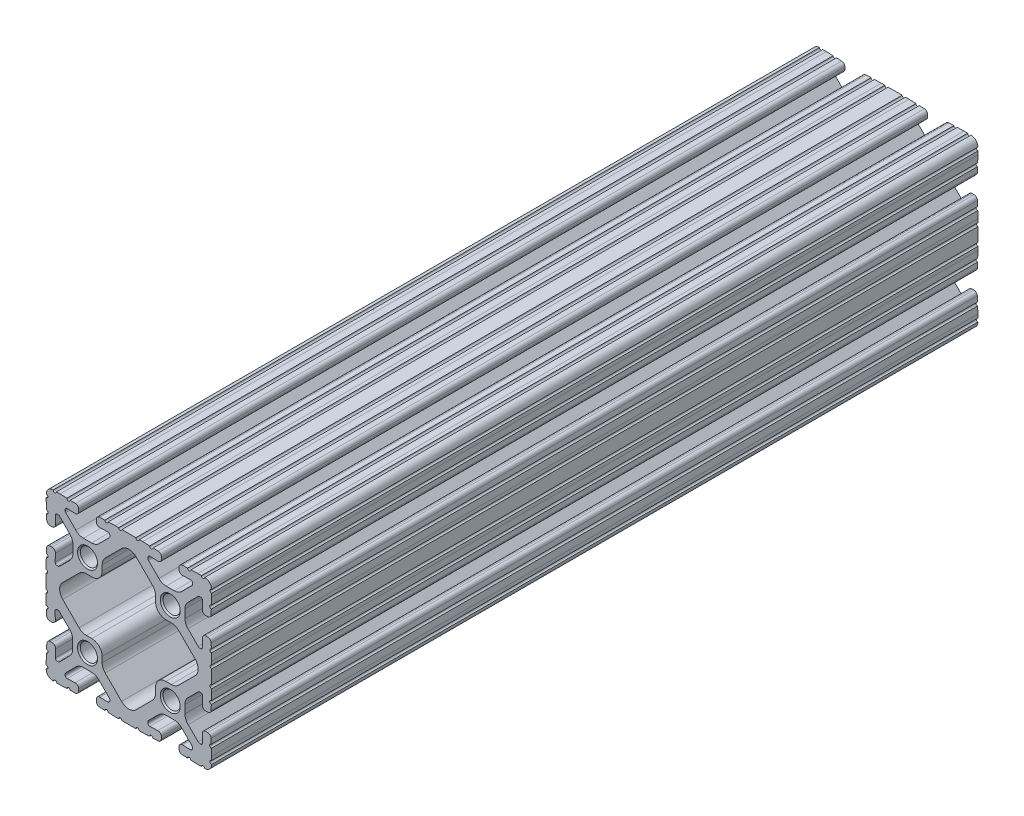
SolidWorks part; units mm, degrees
ref_plane "Front" through (0, 0, 0) normal (0, 0, 1) x (1, 0, 0)
ref_plane "Top" through (0, 0, 0) normal (0, 1, 0) x (1, 0, 0)
ref_plane "Right" through (0, 0, 0) normal (1, 0, 0) x (0, 0, -1)
sketch "Sketch2" plane through (0, 0, 0) normal (0, 0, 1) x (1, 0, 0)
  line L142 (52.4544, 57.1407) -> (50.8101, 57.141)
  line L143 (50.8101, 57.141) -> (47.6093, 57.0298)
  line L144 (46.0862, 56.9768) -> (43.6939, 56.8937)
  line L145 (42.1738, 55.3201) -> (42.1737, 54.4052)
  line L146 (43.8031, 52.8311) -> (47.4764, 52.9587)
  line L147 (48.3962, 52.0701) -> (48.3962, 51.6203)
  line L148 (48.1357, 50.9918) -> (43.3694, 46.2272)
  line L149 (40.0105, 44.8366) -> (36.2054, 44.8372)
  line L150 (32.847, 46.229) -> (28.0824, 50.9953)
  line L151 (27.8221, 51.624) -> (27.8222, 52.1003)
  line L152 (28.7424, 52.9886) -> (32.4156, 52.8597)
  line L153 (34.0457, 54.4333) -> (34.0458, 55.3482)
  line L154 (32.5263, 56.9223) -> (30.1341, 57.0063)
  line L155 (28.611, 57.0598) -> (25.4102, 57.1892)
  line L156 (25.4102, 57.1892) -> (23.7846, 57.1895)
  line L157 (22.2606, 57.1897) -> (15.8208, 57.1953)
  line L158 (14.2968, 57.1955) -> (12.6712, 57.1959)
  line L159 (12.6712, 57.1959) -> (9.4703, 57.0847)
  line L160 (7.9473, 57.0318) -> (5.555, 56.9486)
  line L161 (4.0349, 55.375) -> (4.0347, 54.4601)
  line L162 (5.6642, 52.886) -> (9.3375, 53.0136)
  line L163 (10.2573, 52.125) -> (10.2573, 51.6486)
  line L164 (9.9968, 51.02) -> (5.2305, 46.2554)
  line L165 (1.8716, 44.8649) -> (-1.9295, 44.8655)
  line L166 (-5.4044, 46.378) -> (-10.056, 51.0231)
  line L167 (-10.3168, 51.6316) -> (-10.3167, 52.0805)
  line L168 (-9.3965, 52.9688) -> (-5.7233, 52.8399)
  line L169 (-4.0933, 54.4134) -> (-4.0931, 55.3284)
  line L170 (-5.6127, 56.9025) -> (-8.0049, 56.9864)
  line L171 (-9.5279, 57.0399) -> (-12.7085, 57.1523)
  line L172 (-12.7085, 57.1523) -> (-14.3341, 57.1525)
  line L173 (-19.0383, 52.457) -> (-19.041, 50.8529)
  line L174 (-19.041, 50.8529) -> (-18.9345, 47.6519)
  line L175 (-18.8838, 46.1287) -> (-18.8042, 43.7363)
  line L176 (-17.2328, 42.2139) -> (-16.3179, 42.2124)
  line L177 (-14.7414, 43.8396) -> (-14.8636, 47.513)
  line L178 (-13.9736, 48.4315) -> (-13.5239, 48.4308)
  line L179 (-12.8943, 48.168) -> (-8.1584, 43.3961)
  line L180 (-6.7727, 40.0352) -> (-6.779, 36.2301)
  line L181 (-8.1757, 32.8737) -> (-12.949, 28.1162)
  line L182 (-13.578, 27.8568) -> (-14.0544, 27.8576)
  line L183 (-14.9413, 28.7791) -> (-14.807, 32.4521)
  line L184 (-16.3782, 34.0845) -> (-17.2931, 34.086)
  line L185 (-18.8694, 32.5687) -> (-18.9569, 30.1766)
  line L186 (-19.0126, 28.6537) -> (-19.1297, 25.453)
  line L187 (-19.1297, 25.453) -> (-19.1324, 23.8274)
  line L188 (-19.1349, 22.3034) -> (-19.1454, 15.8982)
  line L189 (-19.1478, 14.3742) -> (-19.1506, 12.7486)
  line L190 (-19.1506, 12.7486) -> (-19.0441, 9.5475)
  line L191 (-18.9934, 8.0244) -> (-18.9138, 5.632)
  line L192 (-17.3425, 4.1096) -> (-16.4276, 4.1081)
  line L193 (-14.851, 5.7352) -> (-14.9733, 9.4087)
  line L194 (-14.0833, 10.3272) -> (-13.6069, 10.3265)
  line L195 (-12.9787, 10.065) -> (-8.2211, 5.2918)
  line L196 (-6.8355, 1.9309) -> (-6.8418, -1.8703)
  line L197 (-8.3594, -5.3429) -> (-12.8976, -9.9877)
  line L198 (-13.5272, -10.2476) -> (-13.9769, -10.2468)
  line L199 (-14.8639, -9.3254) -> (-14.7296, -5.6523)
  line L200 (-16.3007, -4.02) -> (-17.2157, -4.0185)
  line L201 (-18.792, -5.5357) -> (-18.8795, -7.9278)
  line L202 (-18.9352, -9.4508) -> (-19.0522, -12.6685)
  line L203 (-19.0522, -12.6685) -> (-19.0549, -14.2941)
  line L204 (-14.2543, -19.0475) -> (-12.7423, -19.0477)
  line L205 (-12.7423, -19.0477) -> (-9.5414, -18.9365)
  line L206 (-8.0183, -18.8836) -> (-5.6261, -18.8005)
  line L207 (-4.106, -17.2269) -> (-4.1058, -16.312)
  line L208 (-5.7353, -14.7378) -> (-9.4086, -14.8654)
  line L209 (-10.3284, -13.9768) -> (-10.3284, -13.5271)
  line L210 (-10.0685, -12.8991) -> (-5.4141, -8.2375)
  line L211 (-1.9387, -6.7262) -> (1.8625, -6.7269)
  line L212 (5.2208, -8.1187) -> (9.9854, -12.885)
  line L213 (10.2457, -13.5136) -> (10.2456, -13.99)
  line L214 (9.3254, -14.8783) -> (5.6522, -14.7494)
  line L215 (4.0222, -16.3229) -> (4.022, -17.2379)
  line L216 (5.5416, -18.812) -> (7.9338, -18.896)
  line L217 (9.4568, -18.9494) -> (12.6577, -19.0617)
  line L218 (12.6577, -19.0617) -> (14.2833, -19.0619)
  line L219 (15.8073, -19.0623) -> (22.2018, -19.0634)
  line L220 (23.7258, -19.0637) -> (25.3514, -19.064)
  line L221 (25.3514, -19.064) -> (28.5522, -18.9528)
  line L222 (30.0753, -18.8999) -> (32.4676, -18.8167)
  line L223 (33.9877, -17.2432) -> (33.9878, -16.3283)
  line L224 (32.3584, -14.7541) -> (28.6851, -14.8817)
  line L225 (27.7652, -13.9931) -> (27.7653, -13.5167)
  line L226 (28.0258, -12.8882) -> (32.7921, -8.1236)
  line L227 (36.151, -6.733) -> (39.9561, -6.7337)
  line L228 (43.3145, -8.1255) -> (48.0791, -12.8917)
  line L229 (48.3393, -13.5369) -> (48.3393, -13.9872)
  line L230 (47.4191, -14.8755) -> (43.7459, -14.7466)
  line L231 (42.1158, -16.3202) -> (42.1157, -17.2351)
  line L232 (43.6352, -18.8092) -> (46.0275, -18.8932)
  line L233 (47.5505, -18.9467) -> (50.7514, -19.059)
  line L234 (50.7514, -19.059) -> (52.3769, -19.0593)
  line L235 (57.1499, -14.3077) -> (57.1478, -12.665)
  line L236 (57.1478, -12.665) -> (57.0318, -9.4643)
  line L237 (56.9767, -7.9413) -> (56.8901, -5.5492)
  line L238 (55.3143, -4.0313) -> (54.4039, -4.0325)
  line L239 (52.857, -5.6639) -> (52.99, -9.3374)
  line L240 (52.1027, -10.2586) -> (51.653, -10.2591)
  line L241 (51.0235, -9.999) -> (46.3733, -5.3526)
  line L242 (44.8569, -1.8794) -> (44.852, 1.9217)
  line L243 (46.2388, 5.2821) -> (50.9981, 10.0537)
  line L244 (51.6264, 10.3149) -> (52.1028, 10.3155)
  line L245 (52.9924, 9.3966) -> (52.8689, 5.7232)
  line L246 (54.4448, 4.0955) -> (55.3598, 4.0967)
  line L247 (56.9316, 5.6185) -> (57.0121, 8.0109)
  line L248 (57.0633, 9.534) -> (57.1773, 12.735)
  line L249 (57.1773, 12.735) -> (57.1751, 14.3606)
  line L250 (57.1732, 15.8846) -> (57.2038, 22.2854)
  line L251 (57.2019, 23.8094) -> (57.1998, 25.435)
  line L252 (57.1998, 25.435) -> (57.0839, 28.6186)
  line L253 (57.0287, 30.1416) -> (56.9421, 32.5338)
  line L254 (55.3662, 34.0516) -> (54.4513, 34.0504)
  line L255 (52.8796, 32.4186) -> (53.0126, 28.7455)
  line L256 (52.1253, 27.8243) -> (51.649, 27.8237)
  line L257 (51.02, 28.0833) -> (46.2484, 32.8426)
  line L258 (44.8529, 36.1994) -> (44.848, 40.0045)
  line L259 (46.2348, 43.365) -> (50.9941, 48.1365)
  line L260 (51.6403, 48.3977) -> (52.0908, 48.3983)
  line L261 (52.9804, 47.4794) -> (52.8569, 43.806)
  line L262 (54.4329, 42.1783) -> (55.3478, 42.1795)
  line L263 (56.9197, 43.7014) -> (57.0001, 46.0937)
  line L264 (57.0514, 47.6169) -> (57.159, 50.8179)
  line L265 (57.159, 50.8179) -> (57.1569, 52.4434)
  line L266 (41.9931, 29.9735) -> (49.5586, 22.4169)
  line L267 (49.5185, 15.6997) -> (41.953, 8.1432)
  line L268 (38.5955, 6.754) -> (36.0493, 6.7544)
  line L269 (31.2987, 2.0055) -> (31.2982, -0.5407)
  line L270 (29.9064, -3.8991) -> (22.3591, -11.4438)
  line L271 (15.6527, -11.4426) -> (8.108, -3.8952)
  line L272 (6.7174, -0.5364) -> (6.7178, 2.0098)
  line L273 (1.9689, 6.7605) -> (-0.5773, 6.7609)
  line L274 (-3.9357, 8.1527) -> (-11.4893, 15.709)
  line L275 (-11.9231, 21.9335) -> (-3.8956, 29.9639)
  line L276 (-0.5372, 31.3557) -> (2.009, 31.3561)
  line L277 (6.758, 36.1068) -> (6.7575, 38.653)
  line L278 (8.1481, 42.0118) -> (15.6928, 49.5592)
  line L279 (22.3992, 49.5604) -> (29.9466, 42.0157)
  line L280 (31.3384, 38.6573) -> (31.3388, 36.1111)
  line L281 (36.0894, 31.3622) -> (38.6356, 31.3626)
  arc A129 (52.4544, 57.1407) -> (53.9784, 57.1404) centre (53.2164, 57.1406) ccw
  arc A130 (46.0862, 56.9768) -> (47.6093, 57.0298) centre (46.8477, 57.0033) ccw
  arc A131 (43.6939, 56.8937) -> (42.1738, 55.3201) centre (43.7486, 55.3199) ccw
  arc A132 (42.1737, 54.4052) -> (43.8031, 52.8311) centre (43.7485, 54.4049) ccw
  arc A133 (48.3962, 52.0701) -> (47.4764, 52.9587) centre (47.5072, 52.0702) ccw
  arc A134 (48.1357, 50.9918) -> (48.3962, 51.6203) centre (47.5072, 51.6205) ccw
  arc A135 (40.0105, 44.8366) -> (43.3694, 46.2272) centre (40.0114, 49.5864) ccw
  arc A136 (32.847, 46.229) -> (36.2054, 44.8372) centre (36.2062, 49.587) ccw
  arc A137 (27.8221, 51.624) -> (28.0824, 50.9953) centre (28.7111, 51.6238) ccw
  arc A138 (28.7424, 52.9886) -> (27.8222, 52.1003) centre (28.7112, 52.1002) ccw
  arc A139 (32.4156, 52.8597) -> (34.0457, 54.4333) centre (32.4709, 54.4336) ccw
  arc A140 (34.0458, 55.3482) -> (32.5263, 56.9223) centre (32.471, 55.3485) ccw
  arc A141 (28.611, 57.0598) -> (30.1341, 57.0063) centre (29.3725, 57.0331) ccw
  arc A142 (22.2606, 57.1897) -> (23.7846, 57.1895) centre (23.0226, 57.1897) ccw
  arc A143 (14.2968, 57.1955) -> (15.8208, 57.1953) centre (15.0588, 57.1954) ccw
  arc A144 (7.9473, 57.0318) -> (9.4703, 57.0847) centre (8.7088, 57.0583) ccw
  arc A145 (5.555, 56.9486) -> (4.0349, 55.375) centre (5.6097, 55.3748) ccw
  arc A146 (4.0347, 54.4601) -> (5.6642, 52.886) centre (5.6095, 54.4598) ccw
  arc A147 (10.2573, 52.125) -> (9.3375, 53.0136) centre (9.3683, 52.1251) ccw
  arc A148 (9.9968, 51.02) -> (10.2573, 51.6486) centre (9.3683, 51.6488) ccw
  arc A149 (1.8716, 44.8649) -> (5.2305, 46.2554) centre (1.8725, 49.6147) ccw
  arc A150 (-5.4044, 46.378) -> (-1.9295, 44.8655) centre (-1.9287, 49.6153) ccw
  arc A151 (-10.3168, 51.6316) -> (-10.056, 51.0231) centre (-9.4768, 51.6314) ccw
  arc A152 (-9.3965, 52.9688) -> (-10.3167, 52.0805) centre (-9.4277, 52.0803) ccw
  arc A153 (-5.7233, 52.8399) -> (-4.0933, 54.4134) centre (-5.6681, 54.4137) ccw
  arc A154 (-4.0931, 55.3284) -> (-5.6127, 56.9025) centre (-5.6679, 55.3287) ccw
  arc A155 (-9.5279, 57.0399) -> (-8.0049, 56.9864) centre (-8.7664, 57.0132) ccw
  arc A156 (-15.8581, 57.1527) -> (-14.3341, 57.1525) centre (-15.0961, 57.1527) ccw
  arc A157 (-15.8581, 57.1527) -> (-19.0357, 53.981) centre (-15.8737, 53.9908) ccw
  arc A158 (-19.0383, 52.457) -> (-19.0357, 53.981) centre (-19.037, 53.219) ccw
  arc A159 (-18.8838, 46.1287) -> (-18.9345, 47.6519) centre (-18.9092, 46.8903) ccw
  arc A160 (-18.8042, 43.7363) -> (-17.2328, 42.2139) centre (-17.2302, 43.7887) ccw
  arc A161 (-16.3179, 42.2124) -> (-14.7414, 43.8396) centre (-16.3153, 43.7872) ccw
  arc A162 (-13.9736, 48.4315) -> (-14.8636, 47.513) centre (-13.9751, 47.5425) ccw
  arc A163 (-12.8943, 48.168) -> (-13.5239, 48.4308) centre (-13.5253, 47.5418) ccw
  arc A164 (-6.7727, 40.0352) -> (-8.1584, 43.3961) centre (-11.5225, 40.043) ccw
  arc A165 (-8.1757, 32.8737) -> (-6.779, 36.2301) centre (-11.5288, 36.2379) ccw
  arc A166 (-13.578, 27.8568) -> (-12.949, 28.1162) centre (-13.5766, 28.7458) ccw
  arc A167 (-14.9413, 28.7791) -> (-14.0544, 27.8576) centre (-14.0529, 28.7466) ccw
  arc A168 (-14.807, 32.4521) -> (-16.3782, 34.0845) centre (-16.3808, 32.5097) ccw
  arc A169 (-17.2931, 34.086) -> (-18.8694, 32.5687) centre (-17.2957, 32.5112) ccw
  arc A170 (-19.0126, 28.6537) -> (-18.9569, 30.1766) centre (-18.9848, 29.4152) ccw
  arc A171 (-19.1349, 22.3034) -> (-19.1324, 23.8274) centre (-19.1337, 23.0654) ccw
  arc A172 (-19.1478, 14.3742) -> (-19.1454, 15.8982) centre (-19.1467, 15.1362) ccw
  arc A173 (-18.9934, 8.0244) -> (-19.0441, 9.5475) centre (-19.0188, 8.786) ccw
  arc A174 (-18.9138, 5.632) -> (-17.3425, 4.1096) centre (-17.3399, 5.6844) ccw
  arc A175 (-16.4276, 4.1081) -> (-14.851, 5.7352) centre (-16.425, 5.6829) ccw
  arc A176 (-14.0833, 10.3272) -> (-14.9733, 9.4087) centre (-14.0848, 9.4383) ccw
  arc A177 (-12.9787, 10.065) -> (-13.6069, 10.3265) centre (-13.6084, 9.4375) ccw
  arc A178 (-6.8355, 1.9309) -> (-8.2211, 5.2918) centre (-11.5853, 1.9387) ccw
  arc A179 (-8.3594, -5.3429) -> (-6.8418, -1.8703) centre (-11.5916, -1.8624) ccw
  arc A180 (-13.5272, -10.2476) -> (-12.8976, -9.9877) centre (-13.5257, -9.3586) ccw
  arc A181 (-14.8639, -9.3254) -> (-13.9769, -10.2468) centre (-13.9755, -9.3578) ccw
  arc A182 (-14.7296, -5.6523) -> (-16.3007, -4.02) centre (-16.3033, -5.5948) ccw
  arc A183 (-17.2157, -4.0185) -> (-18.792, -5.5357) centre (-17.2183, -5.5933) ccw
  arc A184 (-18.9352, -9.4508) -> (-18.8795, -7.9278) centre (-18.9074, -8.6893) ccw
  arc A185 (-19.0573, -15.8181) -> (-19.0549, -14.2941) centre (-19.0562, -15.0561) ccw
  arc A186 (-19.0573, -15.8181) -> (-15.7783, -19.0471) centre (-15.8828, -15.8738) ccw
  arc A187 (-14.2543, -19.0475) -> (-15.7783, -19.0471) centre (-15.0163, -19.0473) ccw
  arc A188 (-8.0183, -18.8836) -> (-9.5414, -18.9365) centre (-8.7799, -18.9101) ccw
  arc A189 (-5.6261, -18.8005) -> (-4.106, -17.2269) centre (-5.6808, -17.2267) ccw
  arc A190 (-4.1058, -16.312) -> (-5.7353, -14.7378) centre (-5.6806, -16.3117) ccw
  arc A191 (-10.3284, -13.9768) -> (-9.4086, -14.8654) centre (-9.4394, -13.977) ccw
  arc A192 (-10.0685, -12.8991) -> (-10.3284, -13.5271) centre (-9.4394, -13.5272) ccw
  arc A193 (-1.9387, -6.7262) -> (-5.4141, -8.2375) centre (-1.9395, -11.476) ccw
  arc A194 (5.2208, -8.1187) -> (1.8625, -6.7269) centre (1.8616, -11.4767) ccw
  arc A195 (10.2457, -13.5136) -> (9.9854, -12.885) centre (9.3567, -13.5135) ccw
  arc A196 (9.3254, -14.8783) -> (10.2456, -13.99) centre (9.3566, -13.9899) ccw
  arc A197 (5.6522, -14.7494) -> (4.0222, -16.3229) centre (5.597, -16.3232) ccw
  arc A198 (4.022, -17.2379) -> (5.5416, -18.812) centre (5.5968, -17.2381) ccw
  arc A199 (9.4568, -18.9494) -> (7.9338, -18.896) centre (8.6953, -18.9227) ccw
  arc A200 (15.8073, -19.0623) -> (14.2833, -19.0619) centre (15.0453, -19.0622) ccw
  arc A201 (23.7258, -19.0637) -> (22.2018, -19.0634) centre (22.9638, -19.0636) ccw
  arc A202 (30.0753, -18.8999) -> (28.5522, -18.9528) centre (29.3138, -18.9264) ccw
  arc A203 (32.4676, -18.8167) -> (33.9877, -17.2432) centre (32.4129, -17.2429) ccw
  arc A204 (33.9878, -16.3283) -> (32.3584, -14.7541) centre (32.413, -16.328) ccw
  arc A205 (27.7652, -13.9931) -> (28.6851, -14.8817) centre (28.6542, -13.9933) ccw
  arc A206 (28.0258, -12.8882) -> (27.7653, -13.5167) centre (28.6543, -13.5169) ccw
  arc A207 (36.151, -6.733) -> (32.7921, -8.1236) centre (36.1501, -11.4828) ccw
  arc A208 (43.3145, -8.1255) -> (39.9561, -6.7337) centre (39.9553, -11.4835) ccw
  arc A209 (48.3393, -13.5369) -> (48.0791, -12.8917) centre (47.4101, -13.5367) ccw
  arc A210 (47.4191, -14.8755) -> (48.3393, -13.9872) centre (47.4503, -13.9871) ccw
  arc A211 (43.7459, -14.7466) -> (42.1158, -16.3202) centre (43.6906, -16.3205) ccw
  arc A212 (42.1157, -17.2351) -> (43.6352, -18.8092) centre (43.6905, -17.2354) ccw
  arc A213 (47.5505, -18.9467) -> (46.0275, -18.8932) centre (46.789, -18.92) ccw
  arc A214 (53.8715, -19.0595) -> (52.3769, -19.0593) centre (53.1242, -19.0448) ccw
  arc A215 (53.8715, -19.0595) -> (57.1517, -15.8317) centre (53.9772, -15.8862) ccw
  arc A216 (57.1499, -14.3077) -> (57.1517, -15.8317) centre (57.1508, -15.0697) ccw
  arc A217 (56.9767, -7.9413) -> (57.0318, -9.4643) centre (57.0043, -8.7028) ccw
  arc A218 (56.8901, -5.5492) -> (55.3143, -4.0313) centre (55.3163, -5.6061) ccw
  arc A219 (54.4039, -4.0325) -> (52.857, -5.6639) centre (54.4059, -5.5835) ccw
  arc A220 (52.1027, -10.2586) -> (52.99, -9.3374) centre (52.1016, -9.3696) ccw
  arc A221 (51.0235, -9.999) -> (51.653, -10.2591) centre (51.6518, -9.3701) ccw
  arc A222 (44.8569, -1.8794) -> (46.3733, -5.3526) centre (49.6067, -1.8733) ccw
  arc A223 (46.2388, 5.2821) -> (44.852, 1.9217) centre (49.6018, 1.9278) ccw
  arc A224 (51.6264, 10.3149) -> (50.9981, 10.0537) centre (51.6275, 9.4259) ccw
  arc A225 (52.9924, 9.3966) -> (52.1028, 10.3155) centre (52.1039, 9.4265) ccw
  arc A226 (52.8689, 5.7232) -> (54.4448, 4.0955) centre (54.4428, 5.6703) ccw
  arc A227 (55.3598, 4.0967) -> (56.9316, 5.6185) centre (55.3577, 5.6715) ccw
  arc A228 (57.0633, 9.534) -> (57.0121, 8.0109) centre (57.0378, 8.7725) ccw
  arc A229 (57.1732, 15.8846) -> (57.1751, 14.3606) centre (57.1742, 15.1226) ccw
  arc A230 (57.2019, 23.8094) -> (57.2038, 22.2854) centre (57.2029, 23.0474) ccw
  arc A231 (57.0287, 30.1416) -> (57.0839, 28.6186) centre (57.0563, 29.3801) ccw
  arc A232 (56.9421, 32.5338) -> (55.3662, 34.0516) centre (55.3683, 32.4768) ccw
  arc A233 (54.4513, 34.0504) -> (52.8796, 32.4186) centre (54.4534, 32.4756) ccw
  arc A234 (52.1253, 27.8243) -> (53.0126, 28.7455) centre (52.1242, 28.7133) ccw
  arc A235 (51.02, 28.0833) -> (51.649, 27.8237) centre (51.6478, 28.7127) ccw
  arc A236 (44.8529, 36.1994) -> (46.2484, 32.8426) centre (49.6027, 36.2055) ccw
  arc A237 (46.2348, 43.365) -> (44.848, 40.0045) centre (49.5978, 40.0107) ccw
  arc A238 (51.6403, 48.3977) -> (50.9941, 48.1365) centre (51.6415, 47.4647) ccw
  arc A239 (52.9804, 47.4794) -> (52.0908, 48.3983) centre (52.0919, 47.5093) ccw
  arc A240 (52.8569, 43.806) -> (54.4329, 42.1783) centre (54.4309, 43.7531) ccw
  arc A241 (55.3478, 42.1795) -> (56.9197, 43.7014) centre (55.3458, 43.7543) ccw
  arc A242 (57.0514, 47.6169) -> (57.0001, 46.0937) centre (57.0258, 46.8553) ccw
  arc A243 (57.1548, 53.9674) -> (57.1569, 52.4434) centre (57.1559, 53.2054) ccw
  arc A244 (57.1548, 53.9674) -> (53.9784, 57.1404) centre (53.9798, 53.9654) ccw
  circle A245 centre (38.1068, 38.0932) radius 3.2639
  circle A246 centre (0.0068, 38.1) radius 3.2639
  circle A247 centre (0, 0) radius 3.2639
  circle A248 centre (38.1, -0.0068) radius 3.2639
  arc A249 (49.5185, 15.6997) -> (49.5586, 22.4169) centre (46.1799, 19.0784) ccw
  arc A250 (38.5955, 6.754) -> (41.953, 8.1432) centre (38.5964, 11.5038) ccw
  arc A251 (36.0493, 6.7544) -> (31.2987, 2.0055) centre (36.0485, 2.0046) ccw
  arc A252 (29.9064, -3.8991) -> (31.2982, -0.5407) centre (26.5484, -0.5399) ccw
  arc A253 (15.6527, -11.4426) -> (22.3591, -11.4438) centre (19.0065, -8.09) ccw
  arc A254 (6.7174, -0.5364) -> (8.108, -3.8952) centre (11.4672, -0.5372) ccw
  arc A255 (6.7178, 2.0098) -> (1.9689, 6.7605) centre (1.968, 2.0107) ccw
  arc A256 (-3.9357, 8.1527) -> (-0.5773, 6.7609) centre (-0.5765, 11.5107) ccw
  arc A257 (-11.9231, 21.9335) -> (-11.4893, 15.709) centre (-8.1263, 19.0707) ccw
  arc A258 (-0.5372, 31.3557) -> (-3.8956, 29.9639) centre (-0.5363, 26.6059) ccw
  arc A259 (2.009, 31.3561) -> (6.758, 36.1068) centre (2.0082, 36.1059) ccw
  arc A260 (8.1481, 42.0118) -> (6.7575, 38.653) centre (11.5073, 38.6538) ccw
  arc A261 (22.3992, 49.5604) -> (15.6928, 49.5592) centre (19.0466, 46.2066) ccw
  arc A262 (31.3384, 38.6573) -> (29.9466, 42.0157) centre (26.5886, 38.6565) ccw
  arc A263 (31.3388, 36.1111) -> (36.0894, 31.3622) centre (36.0886, 36.112) ccw
  arc A264 (41.9931, 29.9735) -> (38.6356, 31.3626) centre (38.6365, 26.6128) ccw
extrude "Extrude2" add sketch "Sketch2" along normal blind 353.06
hole_wizard "5/16-18 Tapped Hole1" positions "3DSketch1" profile "Sketch3" tap size "5/16-18" standard "Ansi Inch"
sketch3d "3DSketch1"
  line L0 (0.0068, 38.1, 353.06) -> (0.0068, 38.1, 0) construction
  line L1 (0, 0, 353.06) -> (0, 0, 0) construction
  line L2 (38.1, -0.0068, 353.06) -> (38.1, -0.0068, 0) construction
  line L3 (38.1068, 38.0932, 353.06) -> (38.1068, 38.0932, 0) construction
  point P0 (0.0068, 38.1, 353.06)
  point P4 (0, 0, 353.06)
  point P8 (38.1, -0.0068, 353.06)
  point P12 (38.1068, 38.0932, 353.06)
  point P16 (0, 0, 0)
  point P19 (0.0068, 38.1, 0)
  point P21 (38.1068, 38.0932, 0)
  point P23 (38.1, -0.0068, 0)
sketch "Sketch3" plane through (0.0068, 38.1, 353.06) normal (1, 0, 0) x (0, -1, 0)
  line L0 (0, 0) -> (0, 24.8973)
  line L1 (0, 24.8973) -> (3.2639, 22.9362)
  line L2 (3.2639, 22.9362) -> (3.2639, 15.875)
  line L3 (3.2639, 15.875) -> (3.9687, 15.875)
  line L5 (3.9687, 15.875) -> (3.9687, 0.635)
  line L6 (3.9687, 0.635) -> (4.6037, 0)
  line L7 (4.6037, 0) -> (0, 0)
  line L8 (-3.9687, 0.635) -> (-4.6037, 0) construction
  line L10 (0, 24.8973) -> (-3.2639, 22.9362) construction
  line L11 (0, -6.35) -> (0, 107.95) construction
  dimension "Tap Drill Dia." = 6.5278
  dimension "Tap Drill Depth" = 22.9362
  dimension "Thread Major Dia." = 7.9375
  dimension "Thread Depth" = 15.875
  dimension "Near C'Sink Dia." = 9.2075
  dimension "Near C'Sink Angle" = 90
  dimension "Drill Angle" = 118
